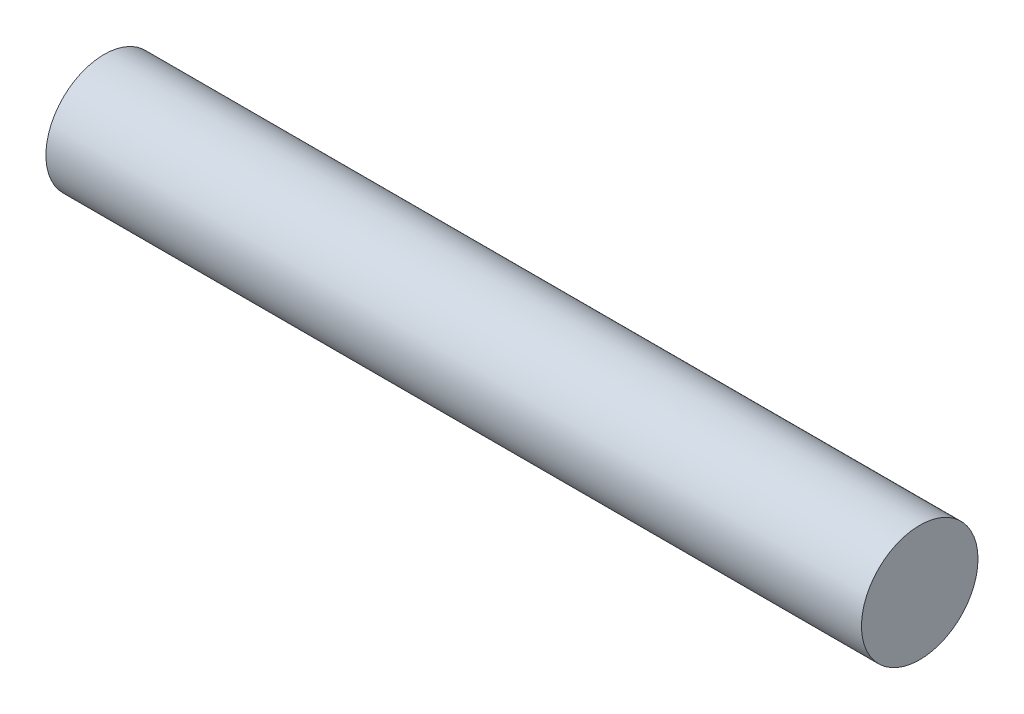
SolidWorks part; units mm, degrees
ref_plane "Front" through (0, 0, 0) normal (0, 0, 1) x (1, 0, 0)
ref_plane "Top" through (0, 0, 0) normal (0, 1, 0) x (1, 0, 0)
ref_plane "Right" through (0, 0, 0) normal (1, 0, 0) x (0, 0, -1)
sketch "Sketch1" plane through (0, 0, 0) normal (1, 0, 0) x (0, 0, -1)
  circle A0 centre (0, 0) radius 5
  dimension "d" = 10
extrude "Base" add sketch "Sketch1" along normal blind 70
sketch "Sketch2" plane through (0, 0, 0) normal (1, 0, 0) x (0, 0, -1)
  line L1 (5, -5) -> (5, 5)
  line L2 (5, 5) -> (-5, 5)
  line L3 (-5, 5) -> (-5, -5)
  line L4 (-5, -5) -> (5, -5)
  circle A0 centre (0, 0) radius 5 construction
  dimension "D1" = 10
extrude "Extrude2" [suppressed] add sketch "Sketch2" along normal blind 70
equation "\"D1@Sketch2\" = \"d@Sketch1\""
equation "\"D1@Extrude2\" = \"l@Base\""
